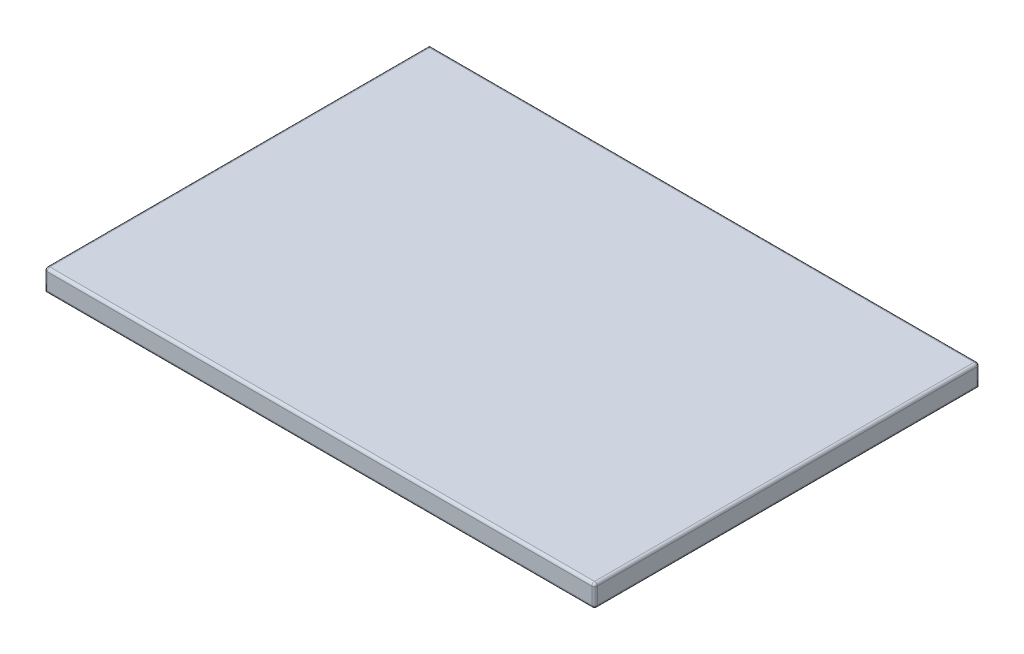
SolidWorks part; units mm, degrees
ref_plane "Front Plane" through (0, 0, 0) normal (0, 0, 1) x (1, 0, 0)
ref_plane "Top Plane" through (0, 0, 0) normal (0, 1, 0) x (1, 0, 0)
ref_plane "Right Plane" through (0, 0, 0) normal (1, 0, 0) x (0, 0, -1)
sketch "Sketch2" plane through (0, 0, 0) normal (0, 1, 0) x (1, 0, 0)
  line L1 (0, 0) -> (100, 0)
  line L2 (0, 0) -> (0, -70)
  line L3 (0, -70) -> (100, -70)
  line L4 (100, 0) -> (100, -70)
  dimension "D1" = 100
  dimension "D2" = 70
extrude "Boss-Extrude1" add sketch "Sketch2" along normal blind 4
fillet "Fillet1" radius 0.5 9 edges at (50, 0, 70) (100, 0, 35) (0, 4, 35) (50, 4, 70) (100, 4, 35) (50, 4, 0) (100, 2, 0) (100, 2, 70) (0, 2, 70)
sketch "Sketch3" plane through (0, 0, 0) normal (-1, 0, 0) x (0, 0, 1)
  line L0 (0, 0) -> (69.5, 0) construction
  line L1 (69.5, 3.5) -> (63.5194, 3.5)
  line L2 (69.5, 3.5) -> (69.5, 0)
  line L3 (69.5, 0) -> (63.5194, 0)
  line L4 (63.5194, 3.5) -> (63.5194, 0)
  line L5 (69.5, 3.5) -> (0, 3.5) construction
  line L6 (61.3346, 3.5) -> (56.2588, 3.5)
  line L7 (61.3346, 3.5) -> (61.3346, 0)
  line L8 (61.3346, 0) -> (56.2588, 0)
  line L9 (56.2588, 3.5) -> (56.2588, 0)
  line L11 (53.3912, 3.5) -> (49.0578, 3.5)
  line L12 (53.3912, 3.5) -> (53.3912, 0)
  line L13 (53.3912, 0) -> (49.0578, 0)
  line L14 (49.0578, 3.5) -> (49.0578, 0)
extrude "Cut-Extrude1" cut sketch "Sketch3" against normal blind 1
